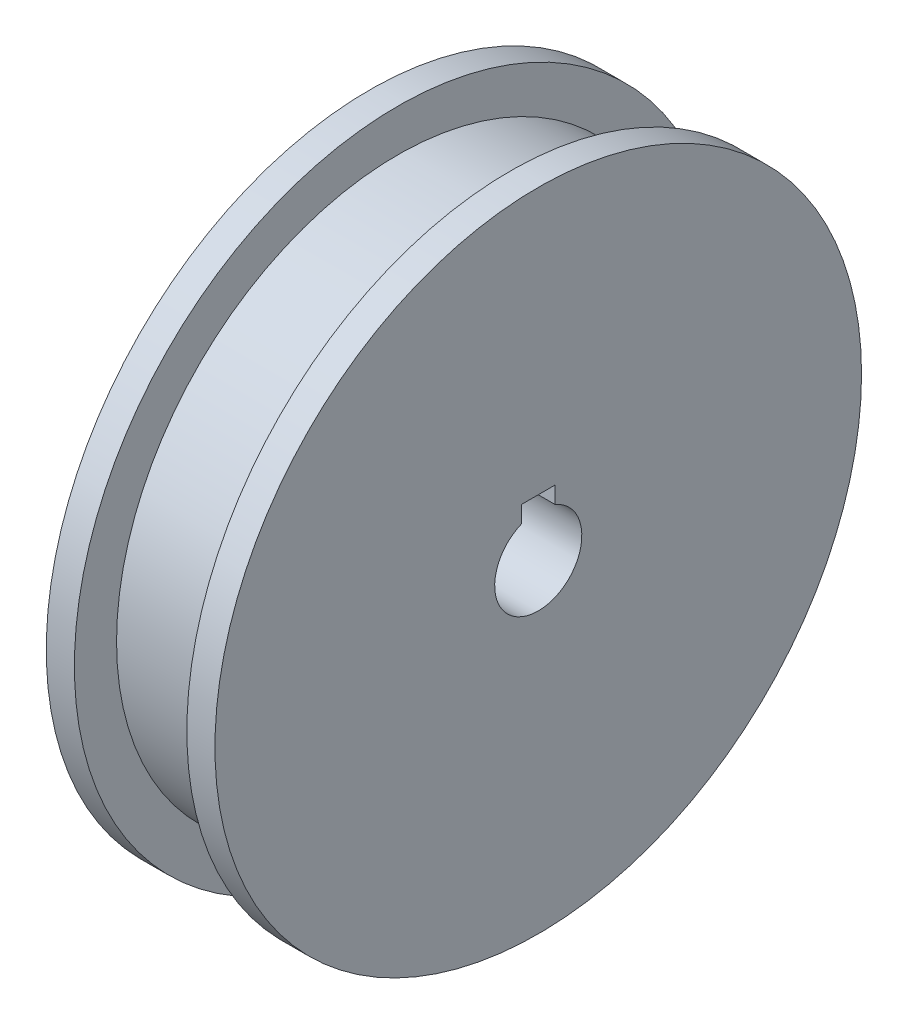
SolidWorks part; units mm, degrees
ref_plane "前视基准面" through (0, 0, 0) normal (0, 0, 1) x (1, 0, 0)
ref_plane "上视基准面" through (0, 0, 0) normal (0, 1, 0) x (1, 0, 0)
ref_plane "右视基准面" through (0, 0, 0) normal (1, 0, 0) x (0, 0, -1)
sketch "草图1" plane through (0, 0, 0) normal (1, 0, 0) x (0, 0, -1)
  circle A0 centre (0, 0) radius 10
  dimension "D1" = 20
extrude "凸台-拉伸1" add sketch "草图1" along normal mid plane 6
sketch "草图2" plane through (3, 0, 0) normal (1, 0, 0) x (0, 0, -1)
  circle A0 centre (0, 0) radius 10 construction
  circle A1 centre (0, 0) radius 10
  circle A4 centre (0, 0) radius 11.5
  circle A5 centre (0, 0) radius 11.5
  dimension "D1" = 1.5
extrude "凸台-拉伸2" add sketch "草图2" against normal blind 1
sketch "草图3" plane through (3, 0, 0) normal (1, 0, 0) x (0, 0, -1)
  line L0 (0, 2.6608) -> (0, -2.3463) construction
  line L1 (0.6, 2.0292) -> (-0.6, 2.0292)
  line L2 (-0.6, 2.0292) -> (-0.6, 1.4292)
  line L3 (0.6, 2.0292) -> (0.6, 1.4292)
  arc A0 (-0.6, 1.4292) -> (0.6, 1.4292) centre (0, 0) ccw
  point P11 (0, 2.0292)
  dimension "D1" = 3.1
  dimension "D2" = 1.2
  dimension "D3" = 0.6
mirror "镜向1" about plane through (0, 0, 0) normal (1, 0, 0) of "凸台-拉伸2"
extrude "切除-拉伸1" cut sketch "草图3" against normal through all
